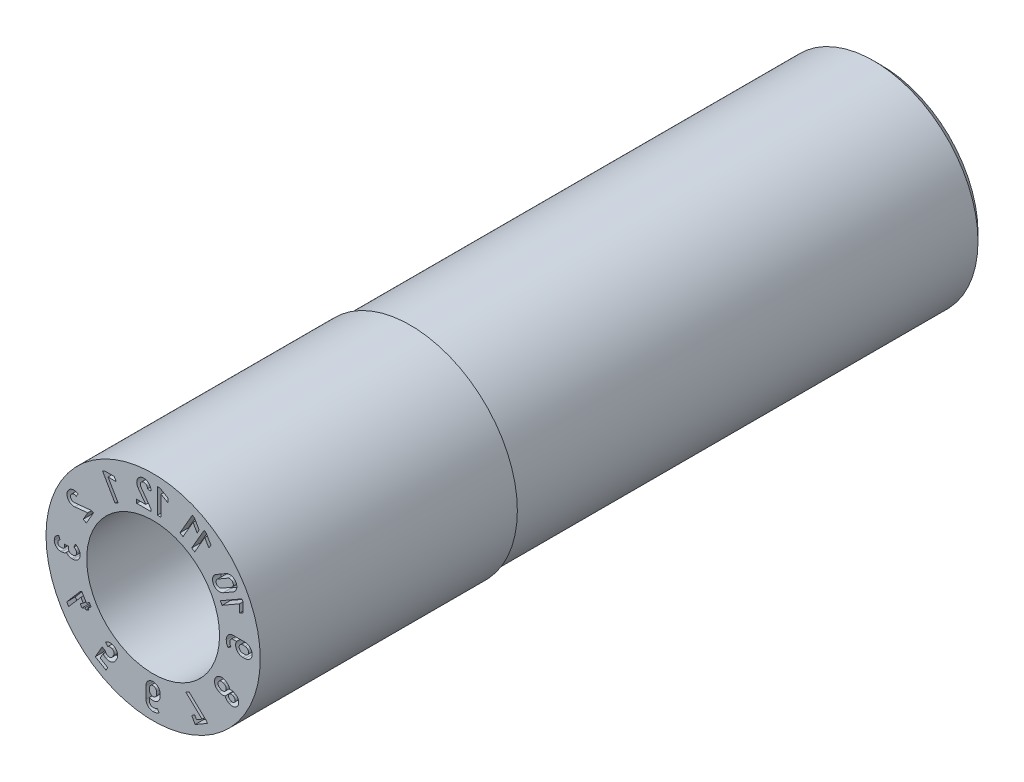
SolidWorks part; units mm, degrees
ref_plane "Front Plane" through (0, 0, 0) normal (0, 0, 1) x (1, 0, 0)
ref_plane "Top Plane" through (0, 0, 0) normal (0, 1, 0) x (1, 0, 0)
ref_plane "Right Plane" through (0, 0, 0) normal (1, 0, 0) x (0, 0, -1)
sketch "Sketch1" plane through (0, 0, 0) normal (1, 0, 0) x (0, 0, -1)
  line L2 (0, 2.5) -> (0, 1.55)
  line L3 (16.75, 2.5) -> (0, 2.5)
  line L4 (-3.7979, 0) -> (49996.2021, 0) construction
  line L8 (14, 0.8) -> (2.8, 0.8)
  line L9 (2.8, 1.55) -> (2.8, 0.8)
  line L10 (2.8, 1.55) -> (0, 1.55)
  line L12 (17, 1.5) -> (17, 2.25)
  line L16 (17, 2.25) -> (16.75, 2.5)
  line L17 (17, 1.5) -> (14, 1.5)
  line L18 (14, 0.8) -> (14, 1.5)
  dimension "D1" = 17
  dimension "D2" = 45
  dimension "D3" = 0.25
  dimension "D4" = 5
  dimension "D5" = 3.1
  dimension "D6" = 2.8
  dimension "D7" = 1.6
  dimension "D8" = 3
  dimension "D9" = 3
revolve "Revolve1" add sketch "Sketch1" angle 360 about L4
sketch "Sketch4" plane through (0, 0, 0) normal (1, 0, 0) x (0, 0, -1)
  line L0 (0, 0) -> (50000, 0) construction
  line L1 (17, -2.25) -> (17, 2.25) construction
  line L2 (6, 3.435) -> (17, 3.435)
  line L3 (6, 3.435) -> (6, 2.435)
  line L4 (6, 2.435) -> (17, 2.435)
  line L5 (17, 3.435) -> (17, 2.435)
  line L6 (16.75, 2.5) -> (0, 2.5) construction
  line L7 (0, 2.5) -> (0, -2.5) construction
  dimension "D1" = 1
  dimension "D2" = 0.065
  dimension "D3" = 6
revolve "Cut-Revolve1" cut sketch "Sketch4" angle 360 about L0
sketch "Sketch2" plane through (0, 0, 0) normal (0, 0, 1) x (1, 0, 0)
  line L0 (1.1898, 1.9464) -> (1.237, 1.9192)
  line L1 (1.237, 1.9192) -> (1.3491, 1.7257)
  line L2 (1.3491, 1.7257) -> (1.3014, 1.643)
  line L3 (1.3014, 1.643) -> (1.2056, 1.8082)
  line L4 (1.2056, 1.8082) -> (0.9717, 1.4031)
  line L5 (0.9717, 1.4031) -> (0.9, 1.4445)
  line L6 (0.9, 1.4445) -> (1.1898, 1.9464)
  line L7 (0.9154, 2.1161) -> (0.9626, 2.0889)
  line L8 (0.9626, 2.0889) -> (1.0747, 1.8954)
  line L9 (1.0747, 1.8954) -> (1.027, 1.8127)
  line L10 (1.027, 1.8127) -> (0.9312, 1.9779)
  line L11 (0.9312, 1.9779) -> (0.6973, 1.5728)
  line L12 (0.6973, 1.5728) -> (0.6256, 1.6142)
  line L13 (0.6256, 1.6142) -> (0.9154, 2.1161)
  line L14 (1.593, 0.9787) -> (1.8296, 1.1153)
  line L15 (1.7468, 1.2587) -> (1.5102, 1.1221)
  line L16 (2.1448, 0.0806) -> (2.091, 0.0806)
  line L17 (2.091, -0.085) -> (2.1448, -0.085)
  line L18 (2.1448, 0.1634) -> (1.8715, 0.1633)
  line L19 (1.745, -0.143) -> (1.8161, -0.1003)
  line L20 (2.1447, -0.1678) -> (2.091, -0.168)
  line L21 (1.9475, 0.0806) -> (1.8715, 0.0806)
  line L22 (1.7902, -1.1733) -> (1.8153, -1.1878)
  line L23 (1.8815, -1.0731) -> (1.8564, -1.0586)
  line L24 (0.7635, -1.5382) -> (0.8384, -1.495)
  line L25 (0.8384, -1.495) -> (1.2485, -1.8816)
  line L26 (1.2485, -1.8816) -> (1.2684, -1.916)
  line L27 (1.2684, -1.916) -> (0.9816, -2.0816)
  line L28 (0.9816, -2.0816) -> (0.8988, -1.9382)
  line L29 (0.8988, -1.9382) -> (0.9705, -1.8968)
  line L30 (0.9705, -1.8968) -> (1.0119, -1.9684)
  line L31 (1.0119, -1.9684) -> (1.1409, -1.8939)
  line L32 (1.1409, -1.8939) -> (0.7635, -1.5382)
  line L33 (1.556, -1.0572) -> (1.5811, -1.0717)
  line L34 (1.6639, -0.9283) -> (1.6388, -0.9138)
  line L35 (1.7053, -0.8566) -> (1.6802, -0.8421)
  line L36 (1.5146, -1.1289) -> (1.5397, -1.1434)
  line L37 (1.7488, -1.245) -> (1.7739, -1.2595)
  line L38 (1.9229, -1.0014) -> (1.8978, -0.9869)
  line L39 (2.071, 1.0024) -> (2.0983, 0.9552)
  line L40 (2.0983, 0.9552) -> (2.0986, 0.7315)
  line L41 (2.0986, 0.7315) -> (2.0159, 0.6838)
  line L42 (2.0159, 0.6838) -> (2.0156, 0.8748)
  line L43 (2.0156, 0.8748) -> (1.6105, 0.6409)
  line L44 (1.6105, 0.6409) -> (1.5691, 0.7126)
  line L45 (1.5691, 0.7126) -> (2.071, 1.0024)
  line L46 (1.7054, 1.3305) -> (1.4688, 1.1939)
  line L47 (1.6344, 0.907) -> (1.871, 1.0436)
  line L48 (0.1016, 2.2866) -> (0.1561, 2.2866)
  line L49 (0.1561, 2.2866) -> (0.35, 2.1751)
  line L50 (0.35, 2.1751) -> (0.35, 2.0796)
  line L51 (0.35, 2.0796) -> (0.1844, 2.1748)
  line L52 (0.1844, 2.1748) -> (0.1844, 1.707)
  line L53 (0.1844, 1.707) -> (0.1016, 1.707)
  line L54 (0.1016, 1.707) -> (0.1016, 2.2866)
  line L55 (-0.3825, 1.7058) -> (-0.0513, 1.7058)
  line L56 (-0.0513, 1.7058) -> (-0.0513, 1.7605)
  line L57 (-0.0513, 1.7605) -> (-0.2841, 2.0838)
  line L58 (-0.135, 2.1197) -> (-0.0517, 2.1197)
  line L59 (-0.3514, 2.0353) -> (-0.1713, 1.7886)
  line L60 (-0.1713, 1.7886) -> (-0.3825, 1.7886)
  line L61 (-0.3825, 1.7886) -> (-0.3825, 1.7058)
  line L62 (-1.1789, 1.9591) -> (-1.1317, 1.9864)
  line L63 (-1.1317, 1.9864) -> (-0.9081, 1.9868)
  line L64 (-0.9081, 1.9868) -> (-0.8603, 1.9041)
  line L65 (-0.8603, 1.9041) -> (-1.0513, 1.9037)
  line L66 (-1.0513, 1.9037) -> (-0.8174, 1.4986)
  line L67 (-0.8174, 1.4986) -> (-0.8891, 1.4572)
  line L68 (-0.8891, 1.4572) -> (-1.1789, 1.9591)
  line L69 (-0.085, -1.8716) -> (-0.085, -1.9254)
  line L70 (0.0805, -1.9254) -> (0.0805, -1.8716)
  line L71 (0.1633, -1.8717) -> (0.1635, -1.9254)
  line L72 (-0.085, -2.0688) -> (-0.085, -2.1448)
  line L73 (-0.1679, -1.8716) -> (-0.1678, -2.1448)
  line L74 (0.1385, -2.2714) -> (0.0958, -2.2003)
  line L75 (-0.8504, -1.6746) -> (-0.8774, -1.7211)
  line L76 (-1.1897, -1.5999) -> (-1.118, -1.6413)
  line L77 (-0.949, -1.6798) -> (-0.9221, -1.6332)
  line L78 (-1.0593, -1.528) -> (-1.1108, -1.4631)
  line L79 (-1.1897, -1.5999) -> (-1.3504, -1.8782)
  line L80 (-1.3504, -1.8782) -> (-1.0995, -2.0231)
  line L81 (-1.0995, -2.0231) -> (-1.058, -1.9514)
  line L82 (-1.058, -1.9514) -> (-1.2373, -1.8479)
  line L83 (-1.2373, -1.8479) -> (-1.1666, -1.7254)
  line L84 (-2.1585, -0.1509) -> (-2.1295, -0.1509)
  line L85 (-1.8977, -0.1674) -> (-1.8687, -0.1674)
  line L86 (-1.8158, 0.1638) -> (-1.8462, 0.0868)
  line L87 (-2.2006, 0.1472) -> (-2.1741, 0.0688)
  line L88 (-2.1585, -0.068) -> (-2.1295, -0.068)
  line L89 (-2.0633, -0.0018) -> (-2.0633, 0.0396)
  line L90 (-2.0633, 0.0396) -> (-1.9805, 0.0396)
  line L91 (-1.9805, 0.0396) -> (-1.9805, -0.0018)
  line L92 (-1.8977, -0.0846) -> (-1.8687, -0.0846)
  line L93 (-2.0153, -1.1001) -> (-1.9714, -1.176)
  line L94 (-1.9714, -1.176) -> (-1.6853, -0.8435)
  line L95 (-1.6853, -0.8435) -> (-1.6317, -0.9364)
  line L96 (-1.6317, -0.9364) -> (-1.7034, -0.9778)
  line L97 (-1.7034, -0.9778) -> (-1.662, -1.0495)
  line L98 (-1.662, -1.0495) -> (-1.5903, -1.0081)
  line L99 (-1.5903, -1.0081) -> (-1.5696, -1.044)
  line L100 (-1.5696, -1.044) -> (-1.4979, -1.0026)
  line L101 (-1.4979, -1.0026) -> (-1.5186, -0.9667)
  line L102 (-1.5186, -0.9667) -> (-1.4469, -0.9253)
  line L103 (-1.4469, -0.9253) -> (-1.4883, -0.8536)
  line L104 (-1.4883, -0.8536) -> (-1.56, -0.895)
  line L105 (-1.56, -0.895) -> (-1.6635, -0.7158)
  line L106 (-1.6635, -0.7158) -> (-1.7054, -0.74)
  line L107 (-1.7054, -0.74) -> (-2.0153, -1.1001)
  line L108 (-1.6306, 0.7605) -> (-1.5589, 0.7191)
  line L109 (-1.5589, 0.7191) -> (-1.3933, 1.0059)
  line L110 (-1.3933, 1.0059) -> (-1.4408, 1.0333)
  line L111 (-1.4408, 1.0333) -> (-1.8371, 0.9933)
  line L112 (-1.7937, 1.1404) -> (-1.7521, 1.2125)
  line L113 (-1.8288, 0.9108) -> (-1.5251, 0.9434)
  line L114 (-1.5251, 0.9434) -> (-1.6306, 0.7605)
  arc A0 (1.5102, 1.1221) -> (1.593, 0.9787) centre (1.5516, 1.0504) ccw
  arc A1 (1.8296, 1.1153) -> (1.7468, 1.2587) centre (1.7882, 1.187) ccw
  arc A2 (2.091, 0.0806) -> (2.091, -0.085) centre (2.091, -0.0022) ccw
  arc A3 (2.1448, -0.085) -> (2.1448, 0.0806) centre (2.1448, -0.0022) ccw
  arc A4 (1.8715, 0.1633) -> (1.7059, -0.0022) centre (1.8716, -0.0023) ccw
  arc A5 (1.7059, -0.0022) -> (1.745, -0.143) centre (1.979, -0.0023) ccw
  arc A6 (2.1447, -0.1678) -> (2.1448, 0.1634) centre (2.1447, -0.0022) ccw
  arc A7 (1.9475, 0.0806) -> (2.091, -0.168) centre (2.0904, -0.0027) ccw
  arc A8 (1.8715, 0.0806) -> (1.789, 0.0041) centre (1.8715, -0.0022) ccw
  arc A9 (1.789, 0.0041) -> (1.8161, -0.1003) centre (1.9547, -0.0086) ccw
  arc A10 (1.8564, -1.0586) -> (1.7902, -1.1733) centre (1.8232, -1.1159) ccw
  arc A11 (1.8153, -1.1878) -> (1.8815, -1.0731) centre (1.8484, -1.1304) ccw
  arc A12 (1.6388, -0.9138) -> (1.556, -1.0572) centre (1.5975, -0.9855) ccw
  arc A13 (1.5811, -1.0717) -> (1.6639, -0.9283) centre (1.6225, -1) ccw
  arc A14 (1.7857, -0.9717) -> (1.7053, -0.8566) centre (1.6225, -1) ccw
  arc A15 (1.6802, -0.8421) -> (1.5146, -1.1289) centre (1.5973, -0.9855) ccw
  arc A16 (1.5397, -1.1434) -> (1.6796, -1.1554) centre (1.6225, -1) ccw
  arc A17 (1.6796, -1.1554) -> (1.7488, -1.245) centre (1.8235, -1.1158) ccw
  arc A18 (1.7739, -1.2595) -> (1.9229, -1.0014) centre (1.8484, -1.1305) ccw
  arc A19 (1.8978, -0.9869) -> (1.7857, -0.9717) centre (1.8235, -1.1147) ccw
  arc A20 (1.4688, 1.1939) -> (1.6344, 0.907) centre (1.5516, 1.0504) ccw
  arc A21 (1.871, 1.0436) -> (1.7054, 1.3305) centre (1.7882, 1.187) ccw
  arc A22 (-0.135, 2.1197) -> (-0.2841, 2.0838) centre (-0.2169, 2.1322) ccw
  arc A23 (-0.0517, 2.1197) -> (-0.3514, 2.0353) centre (-0.2169, 2.1321) ccw
  arc A24 (-0.085, -1.9254) -> (0.0805, -1.9254) centre (-0.0023, -1.9254) ccw
  arc A25 (0.0805, -1.8716) -> (-0.085, -1.8716) centre (-0.0023, -1.8716) ccw
  arc A26 (0.1633, -1.8717) -> (-0.1679, -1.8716) centre (-0.0023, -1.8717) ccw
  arc A27 (-0.085, -2.0688) -> (0.1635, -1.9254) centre (-0.0018, -1.926) ccw
  arc A28 (-0.085, -2.1448) -> (-0.0086, -2.2274) centre (-0.0023, -2.1448) ccw
  arc A29 (-0.0086, -2.2274) -> (0.0958, -2.2003) centre (0.0041, -2.0617) ccw
  arc A30 (-0.1678, -2.1448) -> (-0.0023, -2.3104) centre (-0.0022, -2.1448) ccw
  arc A31 (-0.0023, -2.3104) -> (0.1385, -2.2714) centre (-0.0022, -2.0374) ccw
  arc A32 (-1.1035, -1.7818) -> (-0.8774, -1.7211) centre (-1.0209, -1.638) ccw
  arc A33 (-1.1666, -1.7254) -> (-1.1035, -1.7818) centre (-1.0012, -1.6038) ccw
  arc A34 (-0.8504, -1.6746) -> (-0.911, -1.4483) centre (-0.994, -1.5918) ccw
  arc A35 (-0.911, -1.4483) -> (-1.1108, -1.4631) centre (-1.0001, -1.6024) ccw
  arc A36 (-1.118, -1.6413) -> (-1.0621, -1.7101) centre (-0.9999, -1.6024) ccw
  arc A37 (-1.0621, -1.7101) -> (-0.949, -1.6798) centre (-1.0207, -1.6384) ccw
  arc A38 (-0.9221, -1.6332) -> (-0.9524, -1.5201) centre (-0.9938, -1.5918) ccw
  arc A39 (-0.9524, -1.5201) -> (-1.0593, -1.528) centre (-1, -1.6026) ccw
  arc A40 (-2.2006, 0.1472) -> (-2.3075, -0.0018) centre (-2.1502, -0.0018) ccw
  arc A41 (-2.3075, -0.0018) -> (-2.1585, -0.1509) centre (-2.1585, -0.0018) ccw
  arc A42 (-2.1295, -0.1509) -> (-2.0249, -0.1079) centre (-2.1295, -0.0019) ccw
  arc A43 (-2.0249, -0.1079) -> (-1.8977, -0.1674) centre (-1.8977, -0.0019) ccw
  arc A44 (-1.8687, -0.1674) -> (-1.7032, -0.0018) centre (-1.8687, -0.0018) ccw
  arc A45 (-1.7032, -0.0018) -> (-1.8158, 0.1638) centre (-1.8812, -0.0018) ccw
  arc A46 (-2.1741, 0.0688) -> (-2.2247, -0.0018) centre (-2.1503, -0.0017) ccw
  arc A47 (-2.2247, -0.0018) -> (-2.1585, -0.068) centre (-2.1584, -0.0017) ccw
  arc A48 (-2.1295, -0.068) -> (-2.0633, -0.0018) centre (-2.1295, -0.0018) ccw
  arc A49 (-1.9805, -0.0018) -> (-1.8977, -0.0846) centre (-1.8977, -0.0018) ccw
  arc A50 (-1.8687, -0.0846) -> (-1.7859, -0.0018) centre (-1.8687, -0.0018) ccw
  arc A51 (-1.7859, -0.0018) -> (-1.8462, 0.0868) centre (-1.8812, -0.0018) ccw
  arc A52 (-1.7937, 1.1404) -> (-1.8371, 0.9933) centre (-1.8454, 1.0757) ccw
  arc A53 (-1.7521, 1.2125) -> (-1.8288, 0.9108) centre (-1.8454, 1.0756) ccw
extrude "Cut-Extrude1" cut sketch "Sketch2" against normal blind 0.2
sketch "Sketch3" plane through (0, 0, -2.8) normal (0, 0, 1) x (1, 0, 0)
  line L0 (0, 0) -> (0, 50000) construction
  line L1 (0.4619, 0.8) -> (-0.4619, 0.8)
  line L2 (-0.4619, 0.8) -> (-0.9238, 0)
  line L3 (-0.9238, 0) -> (-0.4619, -0.8)
  line L4 (-0.4619, -0.8) -> (0.4619, -0.8)
  line L5 (0.4619, -0.8) -> (0.9238, 0)
  line L6 (0.9238, 0) -> (0.4619, 0.8)
  line L7 (0, 0) -> (50000, 0) construction
  circle A0 centre (0, 0) radius 0.8 construction
  circle A1 centre (0, 0) radius 0.8 construction
extrude "Cut-Extrude2" cut sketch "Sketch3" against normal blind 1.4
